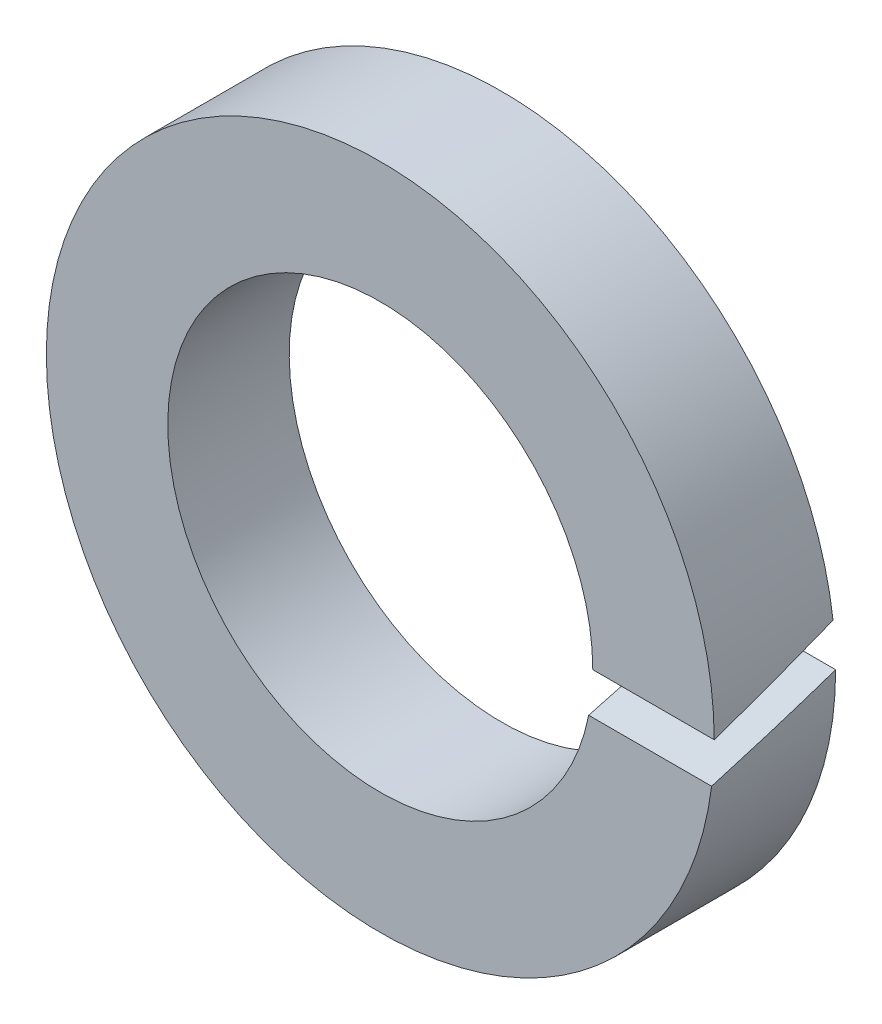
SolidWorks part; units mm, degrees
ref_plane "Plan1" through (0, 0, 0) normal (0, 0, 1) x (1, 0, 0)
ref_plane "Plan2" through (0, 0, 0) normal (0, 1, 0) x (1, 0, 0)
ref_plane "Plan3" through (0, 0, 0) normal (1, 0, 0) x (0, 0, -1)
sketch "Sketch1" plane through (0, 0, 0) normal (0, 0, 1) x (1, 0, 0)
  circle A0 centre (0, 0) radius 8.25
  dimension "D2" = 16.5
extrude "Base-Extrude" add sketch "Sketch1" along normal blind 3
sketch "Sketch2" plane through (0, 0, 3) normal (0, 0, 1) x (1, 0, 0)
  circle A0 centre (0, 0) radius 5.25
  circle A1 centre (0, 0) radius 8.25 construction
  dimension "D1" = 10.5
extrude "Cut-Extrude1" cut sketch "Sketch2" against normal through all
sketch "Sketch3" plane through (0, 0, 0) normal (1, 0, 0) x (0, 0, -1)
  line L0 (0, 1.0258) -> (-3, 0)
  line L3 (-3, 5.25) -> (-3, -5.25) construction
  line L5 (-3, -1.0258) -> (0, 0)
  line L6 (0, -8.25) -> (0, 8.25) construction
  line L7 (-3, 0) -> (-3, -1.0258)
  line L8 (0, 1.0258) -> (0, 0)
  dimension "E" = 0.9706
extrude "Cut-Extrude2" cut sketch "Sketch3" along normal through all
equation "\"E@Sketch3\" = \"D2@Sketch1\"/17"
